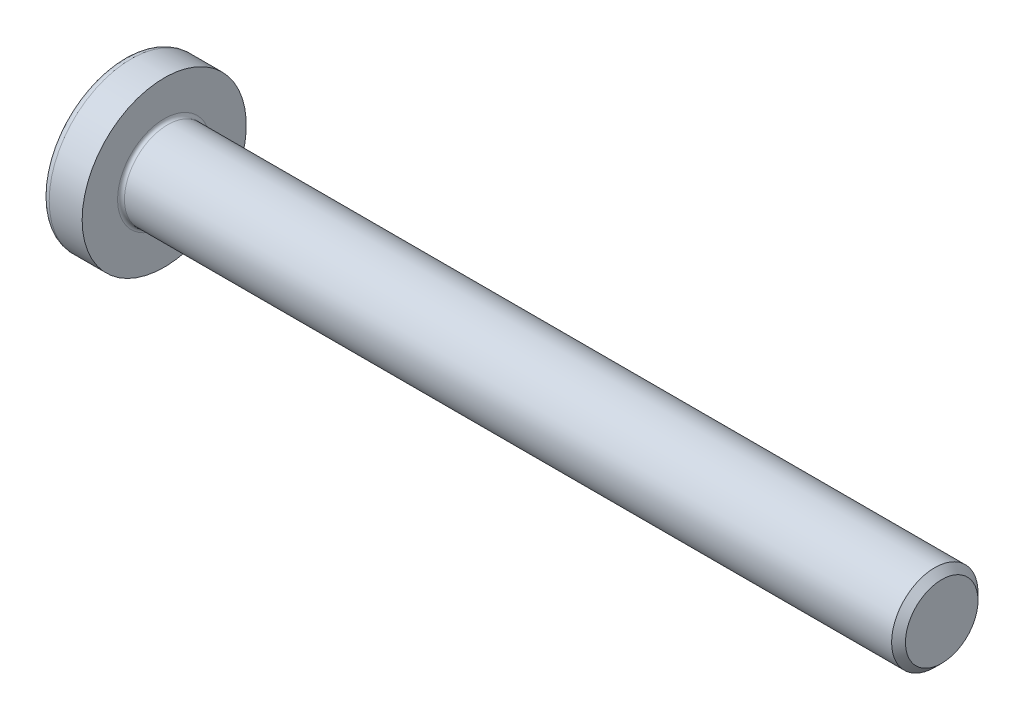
SolidWorks part; units mm, degrees
ref_plane "Plane1" through (0, 0, 0) normal (0, 0, 1) x (1, 0, 0)
ref_plane "Plane2" through (0, 0, 0) normal (0, 1, 0) x (1, 0, 0)
ref_plane "Plane3" through (0, 0, 0) normal (1, 0, 0) x (0, 0, -1)
revolve "Base-Revolve" add sketch "BodySke"
sketch "BodySke" plane through (0, 0, 0) normal (0, 0, 1) x (1, 0, 0)
  line L0 (3.7, 2.5) -> (3.7, 4.75)
  line L1 (4.1, 6.35) -> (4.1, -3.175) construction
  line L2 (-25.4, 0) -> (127, 0) construction
  line L3 (48.7, 0) -> (0, 0)
  line L4 (3.7, 2.5) -> (48.7, 2.5)
  line L5 (48.7, 2.5) -> (48.7, 0)
  line L6 (1.7942, 4.75) -> (3.7, 4.75)
  line L8 (10.7, 6.35) -> (10.7, -3.175) construction
  arc A0 (1.4243, 4.5563) -> (0, 0) centre (8, 0) ccw
  arc A2 (1.4243, 4.5563) -> (1.7942, 4.75) centre (1.7942, 4.3) cw
  dimension "Head_fillet_rad" = 0.45
  dimension "Head_crown_rad" = 8
  dimension "Head_ht" = 3.7
  dimension "Diameter" = 5
  dimension "Length" = 45
  dimension "Head_dia" = 9.5
  dimension "Advance" = 0.8
  dimension "Thread_nom" = 38
fillet "Fillet1" radius 0.2 1 edges at (3.7, 0, 2.5)
sketch "Sketch3" plane through (0, 0, 0) normal (1, 0, 0) x (0, 0, -1)
  line L0 (0.515, -2.35) -> (-0.515, -2.35)
  line L1 (0.515, -2.35) -> (0.515, 2.35)
  line L2 (-0.515, 2.35) -> (0.515, 2.35)
  line L3 (-0.515, 2.35) -> (-0.515, -2.35)
  dimension "D1" = 2.35
  dimension "Cross_dia" = 4.7
  dimension "D2" = 0.515
  dimension "Cross_width" = 1.03
ref_plane "Plane4" through (2.74, 0, 0) normal (1, 0, 0) x (0, 0, -1)
sketch "Sketch4" plane through (2.74, 0, 0) normal (1, 0, 0) x (0, 0, -1)
  line L0 (0.515, -0.9839) -> (-0.515, -0.9839)
  line L1 (0.515, -0.9839) -> (0.515, 0.9839)
  line L2 (-0.515, 0.9839) -> (0.515, 0.9839)
  line L3 (-0.515, 0.9839) -> (-0.515, -0.9839)
  dimension "D1" = 1.03
  dimension "D2" = 1.9678
  dimension "D3" = 0.515
  dimension "D4" = 0.9839
loft "Recess" cut profiles "Sketch3", "Sketch4"
pattern_circular "RecPat" count 2 every 90 about axis through (0, 0, 0) along (1, 0, 0) of "Recess"
sketch "RecCorSke" plane through (0, 0, 0) normal (0, 0, 1) x (1, 0, 0)
  line L0 (-3.175, 0) -> (15.875, 0) construction
  line L1 (-25.4, 0) -> (127, 0) construction
  line L2 (0, 0) -> (0, 1.0426)
  line L3 (0, 1.0426) -> (2.74, 0.851)
  line L4 (2.74, 0.851) -> (3.0165, 0)
  line L5 (3.0165, 0) -> (0, 0)
  dimension "Diameter" = 1.702
  dimension "Depth" = 2.74
  dimension "Draft_angle" = 4
  dimension "Bottom_angle" = 18
revolve "RecessCore" cut sketch "RecCorSke" angle 360 about L0
sketch "ThdSchSke" plane through (0, 0, 0) normal (0, 0, 1) x (1, 0, 0)
  line L0 (10.7, -2.055) -> (10.3884, -2.5)
  line L1 (10.7, -2.055) -> (11.0116, -2.5)
  line L2 (11.0116, -2.5) -> (11.0116, -3.125)
  line L3 (-3.175, 0) -> (5.1513, 0) construction
  line L5 (11.0116, -3.125) -> (10.3884, -3.125)
  line L6 (10.3884, -3.125) -> (10.3884, -2.5)
  dimension "Thread_minor" = 4.11
  dimension "Diameter" = 5
  dimension "Start" = 10.7
  dimension "SideAngle" = 55
  dimension "VeeAngle" = 70
  dimension "Overcut" = 6.25
revolve "ThreadSchematic" [suppressed] cut sketch "ThdSchSke" angle 360 about L3
pattern_linear "ThdSchPat" [suppressed]
chamfer "Chanfrein1" distance 0.4 angle 45 1 edges at (48.7, 0, 2.5)
equation "\"D1@Sketch3\" = \"Cross_dia@Sketch3\" / 2"
equation "\"D2@Sketch3\" = \"Cross_width@Sketch3\" / 2"
equation "\"Depth@RecCorSke\" = \"Cross_depth@Plane4\""
equation "\"D1@Sketch4\" = \"Cross_width@Sketch3\""
equation "\"D2@Sketch4\" = \"Cross_dia@Sketch3\" - 2.0 * \"Cross_depth@Plane4\" * tan(26.5  * 0.017453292)"
equation "\"D3@Sketch4\" = \"D1@Sketch4\" / 2"
equation "\"D4@Sketch4\" = \"D2@Sketch4\" / 2"
equation "\"Thread_length@ThreadCosmetic\" = ((sgn( (\"Length@BodySke\" - \"Advance@BodySke\" * 2.0 ) - \"Thread_nom@BodySke\" )-1)*( (\"Length@BodySke\" - \"Advance@BodySke\" * 2.0 ) - \"Thread_nom@BodySke\" ))/-2+ \"Thread_"
equation "\"Thread_minor@ThdSchSke\" = \"Thread_minor@ThreadCosmetic\""
equation "\"Diameter@ThdSchSke\" = \"Diameter@BodySke\""
equation "\"Overcut@ThdSchSke\" = \"Diameter@BodySke\" * 1.25"
equation "\"Start@ThdSchSke\" = \"Head_ht@BodySke\" + \"Length@BodySke\" - \"Thread_length@ThreadCosmetic\"  '---Non-countersunk---"
equation "\"Num_threads@ThdSchPat\" = int( \"Thread_length@ThreadCosmetic\" / \"Advance@BodySke\" + 0.999 )  + 1"
equation "\"Advance@ThdSchPat\" = \"Thread_length@ThreadCosmetic\" /  (\"Num_threads@ThdSchPat\" - 1) 'relax it"
